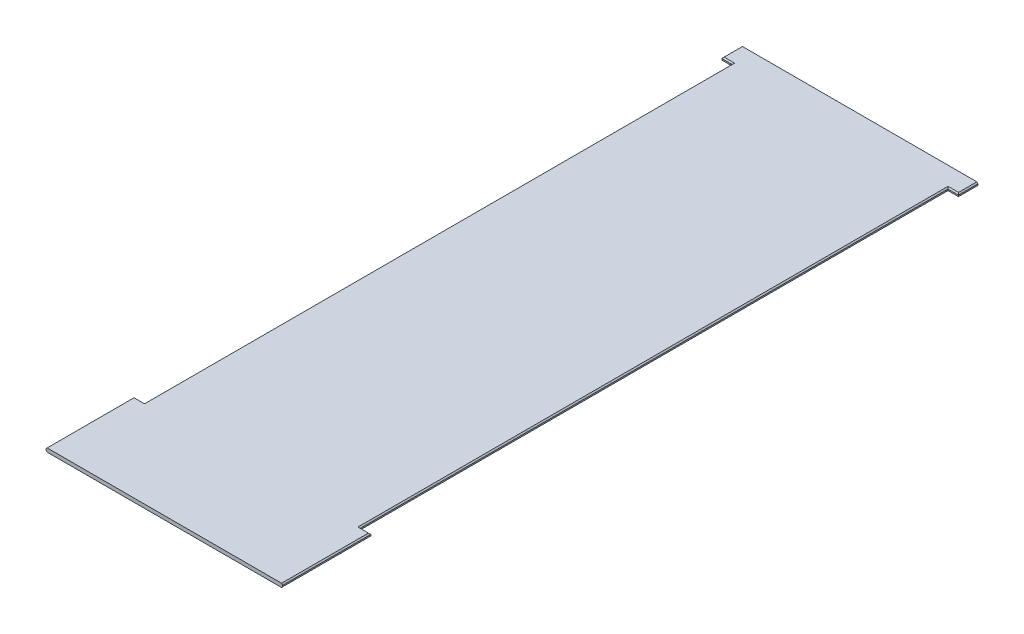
SolidWorks part; units mm, degrees
ref_plane "Front Plane" through (0, 0, 0) normal (1, 0, 0) x (0, 1, 0)
ref_plane "Top Plane" through (0, 0, 0) normal (0, 0, 1) x (0, 1, 0)
ref_plane "Right Plane" through (0, 0, 0) normal (0, 1, 0) x (-1, 0, 0)
sketch "Sketch2"
sketch_block_instance "Block5-1"
sketch_block "Block5" parameters "D1"=79.2, "D2"=79.2
extrude "Boss-Extrude2" add sketch "Sketch2" along normal mid plane 19.05
chamfer "Chamfer1" distance 6 angle 45 32 edges at (499.4616, 0, -1445.0719) (526.3616, 9.525, -1445.0719) (526.3616, -9.525, -1445.0719) (553.2616, 0, -1445.0719) (553.2616, 9.525, -1495.0719) (553.2616, 0, -1545.0719) (553.2616, -9.525, -1495.0719) (499.4616, 9.525, 60.9281) (499.4616, -9.525, 60.9281) (526.3616, 9.525, 1566.9281) (499.4616, 0, 1566.9281) (526.3616, -9.525, 1566.9281) (553.2616, 0, 2018.1281) (553.2616, 9.525, 1792.5281) (553.2616, 0, 1566.9281) (553.2616, -9.525, 1792.5281) (-659.9384, 0, 1566.9281) (-659.9384, 9.525, 1792.5281) (-659.9384, 0, 2018.1281) (-659.9384, -9.525, 1792.5281) (-633.0384, 9.525, 1566.9281) (-633.0384, -9.525, 1566.9281) (-606.1384, 9.525, 60.9281) (-606.1384, 0, 1566.9281) (-606.1384, -9.525, 60.9281) (-633.0384, 9.525, -1445.0719) (-606.1384, 0, -1445.0719) (-633.0384, -9.525, -1445.0719) (-659.9384, 0, -1545.0719) (-659.9384, 9.525, -1495.0719) (-659.9384, 0, -1445.0719) (-659.9384, -9.525, -1495.0719)
